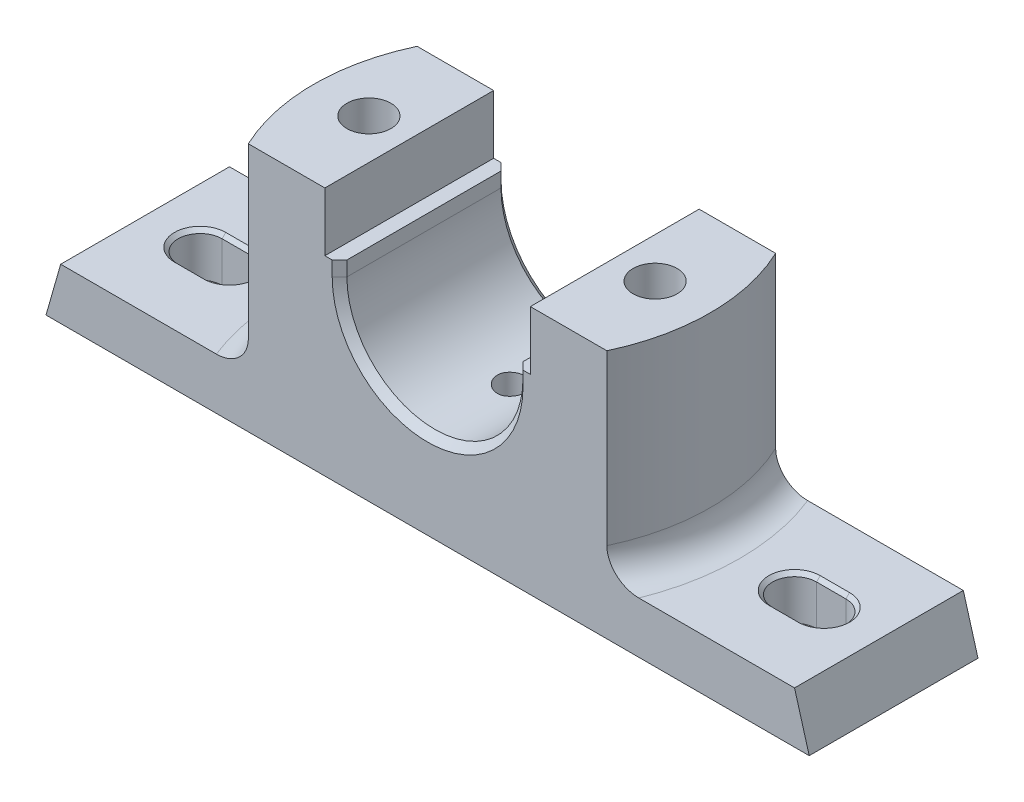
SolidWorks part; units mm, degrees
ref_plane "Front" through (0, 0, 0) normal (0, 0, 1) x (1, 0, 0)
ref_plane "Top" through (0, 0, 0) normal (0, 1, 0) x (1, 0, 0)
ref_plane "Right" through (0, 0, 0) normal (1, 0, 0) x (0, 0, -1)
sketch "Sketch1" plane through (0, 0, 0) normal (0, 0, 1) x (1, 0, 0)
  line L0 (-104, 0) -> (104, 0)
  line L1 (0, 91.4502) -> (0, -4.8887) construction
  line L2 (104, 0) -> (100, 14)
  line L3 (-104, 0) -> (-100, 14)
  line L4 (100, 14) -> (54, 14)
  line L5 (-100, 14) -> (-54, 14)
  line L6 (54, 14) -> (54, 68)
  line L7 (-54, 14) -> (-54, 68)
  line L8 (54, 68) -> (28, 68)
  line L9 (-54, 68) -> (-28, 68)
  line L10 (28, 68) -> (28, 52)
  line L11 (-28, 68) -> (-28, 52)
  line L12 (28, 52) -> (24, 52)
  line L13 (-28, 52) -> (-24, 52)
  line L14 (24, 52) -> (24, 48)
  line L15 (-24, 52) -> (-24, 48)
  arc A0 (24, 48) -> (0, 24) centre (0, 48) cw
  arc A1 (-24, 48) -> (0, 24) centre (0, 48) ccw
  dimension "D7" = 48
  dimension "D1" = 208
  dimension "D2" = 4
  dimension "D3" = 14
  dimension "D4" = 56
  dimension "D5" = 16
  dimension "D6" = 4
  dimension "D8" = 68
  dimension "D9" = 54
extrude "Extrude1" add sketch "Sketch1" along normal mid plane 46
sketch "Sketch3" plane through (0, 68, 0) normal (0, 1, 0) x (-1, 0, 0)
  line L0 (28, -23) -> (54, -23) construction
  line L1 (28, 23) -> (54, 23) construction
  line L2 (54, 23) -> (54, -23) construction
  line L3 (0, 0) -> (0, 34.4965) construction
  line L4 (0, 23) -> (0, -23) construction
  line L5 (-48.8569, 23) -> (48.8569, 23)
  line L6 (-48.8569, -23) -> (48.8569, -23)
  arc A0 (48.8569, -23) -> (48.8569, 23) centre (0, 0) ccw
  arc A1 (-48.8569, -23) -> (-48.8569, 23) centre (0, 0) cw
extrude "Cut-Extrude1" cut sketch "Sketch3" against normal up to surface (54 mm away) flip side to cut
sketch "Sketch6" plane through (0, 0, 0) normal (0, -1, 0) x (1, 0, 0)
  line L0 (-97.5, -17.5) -> (97.5, 17.5) construction
  line L1 (-97.5, 17.5) -> (97.5, 17.5)
  line L2 (-97.5, 17.5) -> (-97.5, -17.5)
  line L3 (-97.5, -17.5) -> (97.5, -17.5)
  line L4 (97.5, 17.5) -> (97.5, -17.5)
  dimension "D1" = 195
  dimension "D2" = 35
extrude "Cut-Extrude5" cut sketch "Sketch6" against normal blind 2
sketch "Sketch4" plane through (0, 2, 0) normal (0, -1, 0) x (1, 0, 0)
  line L0 (0, 31.712) -> (0, -36.3528) construction
  line L2 (0, 23) -> (0, -23) construction
  line L3 (52, -13) -> (26, 13) construction
  line L4 (26, 13) -> (52, 13)
  line L5 (26, 13) -> (26, -13)
  line L6 (26, -13) -> (52, -13)
  line L7 (52, 13) -> (52, -13)
  line L8 (-52, 13) -> (-52, -13)
  line L9 (-26, -13) -> (-52, -13)
  line L10 (-26, 13) -> (-26, -13)
  line L11 (-26, 13) -> (-52, 13)
  circle A0 centre (39, 0) radius 6
  circle A1 centre (-39, 0) radius 6
  dimension "D3" = 12
  dimension "D1" = 78
  dimension "D2" = 26
extrude "Cut-Extrude2" cut sketch "Sketch4" against normal blind 10 contours L4 L7 L6 L5 | L11 L8 L9 L10
other "Hole1"
sketch "Sketch7" plane through (0, 12, 0) normal (0, -1, 0) x (1, 0, 0)
  line L0 (-26, -13) -> (-52, 13) construction
  circle A0 centre (-39, 0) radius 6
  dimension "D1" = 12
other "Hole2"
sketch "Sketch8" plane through (0, 12, 0) normal (0, -1, 0) x (1, 0, 0)
  line L0 (52, -13) -> (26, 13) construction
  circle A0 centre (39, 0) radius 6
  dimension "D1" = 12
sketch "Sketch5"
  line L0 (0, 36.3528) -> (0, -48.1095) construction
  line L1 (0, 23) -> (0, -23) construction
  line L2 (77, 6) -> (85, -6) construction
  line L3 (77, 6) -> (85, 6)
  line L4 (-77, -6) -> (-85, -6)
  line L5 (77, -6) -> (85, -6)
  line L6 (-77, 6) -> (-85, 6)
  arc A0 (77, 6) -> (77, -6) centre (77, 0) ccw
  arc A1 (85, -6) -> (85, 6) centre (85, 0) ccw
  arc A2 (-85, -6) -> (-85, 6) centre (-85, 0) cw
  arc A3 (-77, 6) -> (-77, -6) centre (-77, 0) cw
  point P10 (81, 0)
  point P17 (-81, 0)
chamfer "Chamfer1" distance 2 angle 45 6 edges at (24, 50, 23) (-24, 50, 23) (0, 24, 23) (24, 50, -23) (-24, 50, -23) (0, 24, -23)
fillet "Fillet1" radius 8 2 edges at (-54, 14, 0) (54, 14, 0)
extrude "Cut-Extrude4" cut sketch "Sketch5" against normal through all
chamfer "Chamfer2" distance 1 angle 45 8 edges at (81, 14, -6) (71, 14, 0) (91, 14, 0) (81, 14, 6) (-81, 14, -6) (-91, 14, 0) (-71, 14, 0) (-81, 14, 6)
sketch "Sketch9" plane through (0, 0, 0) normal (0, 0, 1) x (1, 0, 0)
  line L0 (0, 0) -> (0, 39.061) construction
  line L3 (0, 24) -> (0, 16)
  line L4 (0, 16) -> (4, 16)
  line L5 (4, 24.3357) -> (4, 16)
  arc A1 (-24, 48) -> (24, 48) centre (0, 48) ccw construction
  arc A2 (0, 24) -> (4, 24.3357) centre (0, 48) ccw
  dimension "D1" = 8
  dimension "D2" = 8
revolve "Cut-Revolve3" cut sketch "Sketch9" angle 360 about L0
